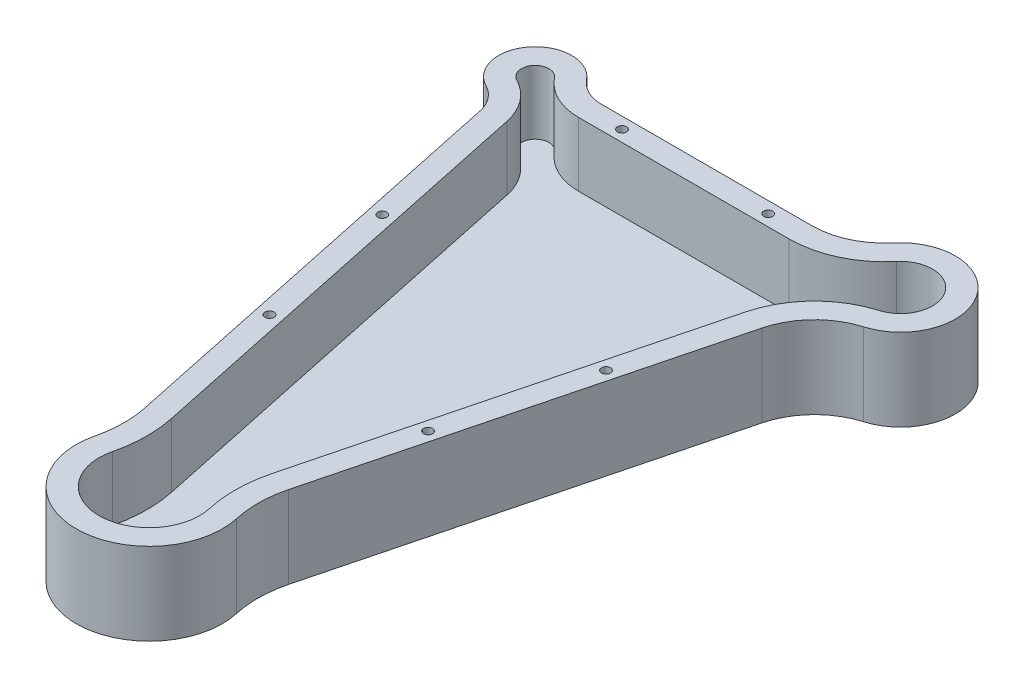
SolidWorks part; units mm, degrees
ref_plane "Front Plane" through (0, 0, 0) normal (0, 0, 1) x (1, 0, 0)
ref_plane "Top Plane" through (0, 0, 0) normal (0, 1, 0) x (1, 0, 0)
ref_plane "Right Plane" through (0, 0, 0) normal (1, 0, 0) x (0, 0, -1)
sketch "Sketch1" plane through (0, 0, 0) normal (0, 1, 0) x (1, 0, 0)
  line L0 (-111.2326, 103.0165) -> (-48.8796, -192.5701)
  line L1 (50.134, -191.457) -> (117.4389, 70.3711)
  line L2 (73.124, 149.2623) -> (-73.124, 149.2623)
  line L3 (0, 149.2623) -> (0, -149.2623) construction
  line L4 (-112.7798, 142.9123) -> (141.2202, 142.9123) construction
  line L5 (-44.45, -213.5688) -> (44.45, -213.5688) construction
  arc A0 (-124.4327, 120.3431) -> (-92.9519, 158.7873) centre (-112.7798, 142.9123) cw
  arc A1 (152.1141, 106.4029) -> (112.0361, 167.4051) centre (141.2202, 142.9123) ccw
  arc A2 (49.5739, -227.0686) -> (-49.3755, -226.2166) centre (0, -238.1623) cw
  arc A3 (-92.9519, 158.7873) -> (-73.124, 149.2623) centre (-73.124, 174.6623) ccw
  arc A4 (-124.4327, 120.3431) -> (-111.2326, 103.0165) centre (-136.0856, 97.7738) cw
  arc A5 (112.0361, 167.4051) -> (73.124, 149.2623) centre (73.124, 200.0623) cw
  arc A6 (152.1141, 106.4029) -> (117.4389, 70.3711) centre (166.6394, 57.7238) ccw
  arc A7 (-49.3755, -226.2166) -> (-48.8796, -192.5701) centre (-123.4388, -208.2981) ccw
  arc A8 (49.5739, -227.0686) -> (50.134, -191.457) centre (123.9347, -210.428) cw
  point P16 (-114.3, 117.5578)
  point P21 (127, 107.5655)
  dimension "D1" = 25.4
  dimension "D2" = 38.1
  dimension "D3" = 50.8
  dimension "D8" = 25.4
  dimension "D12" = 50.8
  dimension "D13" = 76.2
  dimension "D4" = 254
  dimension "D5" = 406.4
  dimension "D6" = 88.9
  dimension "D7" = 6.35
  dimension "D9" = 127
  dimension "D10" = 44.45
  dimension "D11" = 114.3
extrude "Extrude1" add sketch "Sketch1" along normal blind 12.7
sketch "Sketch2" plane through (0, 12.7, 0) normal (0, 1, 0) x (-1, 0, 0)
  line L3 (111.2326, -103.0165) -> (48.8796, 192.5701)
  line L4 (-50.134, 191.457) -> (-117.4389, -70.3711)
  line L5 (-73.124, -149.2623) -> (73.124, -149.2623)
  line L6 (111.2326, -103.0165) -> (48.8796, 192.5701)
  line L7 (-50.134, 191.457) -> (-117.4389, -70.3711)
  line L8 (-73.124, -149.2623) -> (73.124, -149.2623)
  arc A9 (92.9519, -158.7873) -> (73.124, -149.2623) centre (73.124, -174.6623) ccw
  arc A10 (92.9519, -158.7873) -> (124.4327, -120.3431) centre (112.7798, -142.9123) ccw
  arc A11 (111.2326, -103.0165) -> (124.4327, -120.3431) centre (136.0856, -97.7738) ccw
  arc A12 (49.3755, 226.2166) -> (48.8796, 192.5701) centre (123.4388, 208.2981) ccw
  arc A13 (49.3755, 226.2166) -> (-49.5739, 227.0686) centre (0, 238.1623) ccw
  arc A14 (-50.134, 191.457) -> (-49.5739, 227.0686) centre (-123.9347, 210.428) ccw
  arc A15 (-152.1141, -106.4029) -> (-117.4389, -70.3711) centre (-166.6394, -57.7238) ccw
  arc A16 (-152.1141, -106.4029) -> (-112.0361, -167.4051) centre (-141.2202, -142.9123) ccw
  arc A17 (-73.124, -149.2623) -> (-112.0361, -167.4051) centre (-73.124, -200.0623) ccw
  arc A18 (92.9519, -158.7873) -> (73.124, -149.2623) centre (73.124, -174.6623) ccw
  arc A19 (92.9519, -158.7873) -> (124.4327, -120.3431) centre (112.7798, -142.9123) ccw
  arc A20 (111.2326, -103.0165) -> (124.4327, -120.3431) centre (136.0856, -97.7738) ccw
  arc A21 (49.3755, 226.2166) -> (48.8796, 192.5701) centre (123.4388, 208.2981) ccw
  arc A22 (49.3755, 226.2166) -> (-49.5739, 227.0686) centre (0, 238.1623) ccw
  arc A23 (-50.134, 191.457) -> (-49.5739, 227.0686) centre (-123.9347, 210.428) ccw
  arc A24 (-152.1141, -106.4029) -> (-117.4389, -70.3711) centre (-166.6394, -57.7238) ccw
  arc A25 (-152.1141, -106.4029) -> (-112.0361, -167.4051) centre (-141.2202, -142.9123) ccw
  arc A26 (-73.124, -149.2623) -> (-112.0361, -167.4051) centre (-73.124, -200.0623) ccw
  dimension "D1" = 0
extrude "Extrude-Thin1" add sketch "Sketch2" along normal blind 44.45 thin
hole_wizard "1/4-28 Tapped Hole1" positions "Sketch4" profile "Sketch3" tap size "1/4-28" standard "Ansi Inch"
sketch "Sketch4" plane through (0, 57.15, 0) normal (0, 1, 0) x (-1, 0, 0)
  line L0 (-88.7462, 9.3663) -> (-63.4515, 107.7672) construction
  line L2 (-34.7589, 187.5047) -> (-102.0638, -74.3234) construction
  line L3 (-50.134, 191.457) -> (-117.4389, -70.3711) construction
  line L4 (-50.8, -141.3248) -> (50.8, -141.3248) construction
  line L5 (61.8042, 92.8446) -> (82.7748, -6.5676) construction
  line L7 (111.2326, -103.0165) -> (48.8796, 192.5701) construction
  line L8 (95.6994, -106.2932) -> (33.3464, 189.2934) construction
  line L10 (-73.124, -149.2623) -> (73.124, -149.2623) construction
  line L11 (-73.124, -133.3873) -> (73.124, -133.3873) construction
  line L12 (0, -149.2623) -> (0, -72.4728) construction
  line L13 (-83.7865, 60.5429) -> (-109.7615, 67.22) construction
  line L14 (80.0561, 44.7768) -> (135.0194, 56.3711) construction
  point P1 (50.8, -141.3248)
  point P2 (-50.8, -141.3248)
  point P3 (-88.7462, 9.3663)
  point P4 (-63.4515, 107.7672)
  point P5 (61.8042, 92.8446)
  point P6 (82.7748, -6.5676)
  dimension "D1" = 50.8
  dimension "D2" = 50.8
  dimension "D3" = 50.8
  dimension "D4" = 50.8
  dimension "D5" = 50.8
  dimension "D6" = 50.8
sketch "Sketch3" plane through (-50.8, 57.15, -141.3248) normal (1, 0, 0) x (0, 0, 1)
  line L0 (0, 0) -> (0, 17.0457)
  line L1 (0, 17.0457) -> (2.7051, 15.4203)
  line L2 (2.7051, 15.4203) -> (2.7051, 12.7)
  line L3 (2.7051, 12.7) -> (3.175, 12.7)
  line L4 (3.175, 12.7) -> (3.175, 0)
  line L5 (3.175, 0) -> (0, 0)
  line L10 (0, 17.0457) -> (-2.7051, 15.4203) construction
  line L11 (0, -6.35) -> (0, 107.95) construction
  dimension "Tap Drill Dia." = 5.4102
  dimension "Tap Drill Depth" = 15.4203
  dimension "Thread Major Dia." = 6.35
  dimension "Thread Depth" = 12.7
  dimension "Drill Angle" = 118
